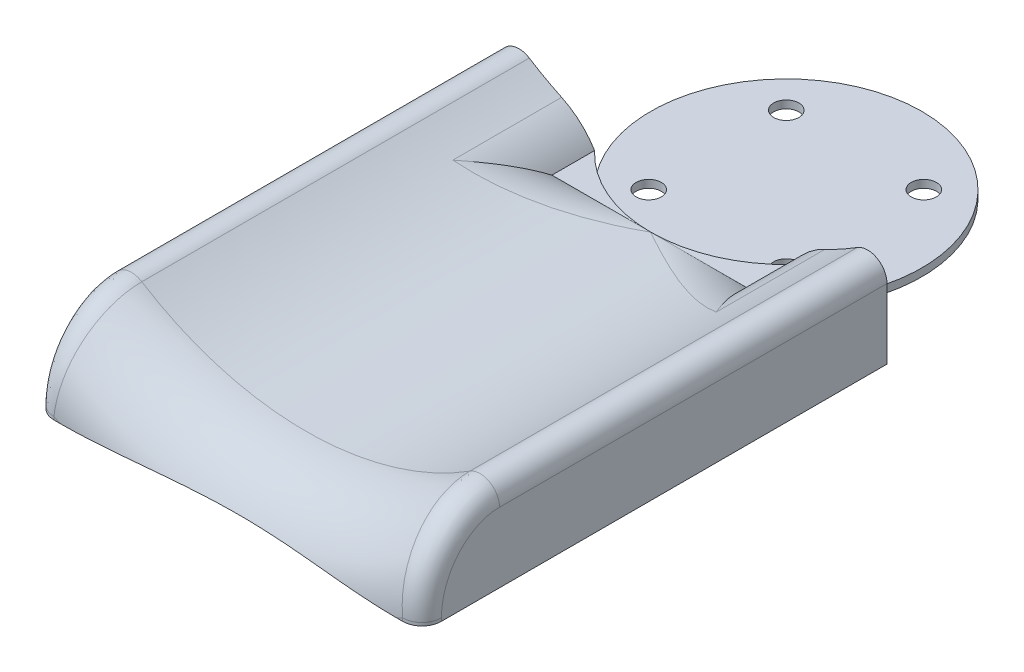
SolidWorks part; units mm, degrees
ref_plane "Front Plane" through (0, 0, 0) normal (0, 0, 1) x (1, 0, 0)
ref_plane "Top Plane" through (0, 0, 0) normal (0, 1, 0) x (1, 0, 0)
ref_plane "Right Plane" through (0, 0, 0) normal (1, 0, 0) x (0, 0, -1)
sketch "Sketch1" plane through (0, 0, 0) normal (0, 1, 0) x (1, 0, 0)
  circle A0 centre (0, 0) radius 35
  dimension "D1" = 70
extrude "Boss-Extrude1" add sketch "Sketch1" along normal blind 2
sketch "Sketch2" plane through (0, 2, 0) normal (0, 1, 0) x (1, 0, 0)
  circle A0 centre (-17.75, 17.75) radius 3.25
  circle A1 centre (17.75, 17.75) radius 3.25
  circle A2 centre (17.75, -17.75) radius 3.25
  circle A3 centre (-17.75, -17.75) radius 3.25
  dimension "D1" = 6.5
  dimension "D2" = 35.5
  dimension "D3" = 17.75
  dimension "D4" = 35.5
  dimension "D5" = 17.75
  dimension "D6" = 35.5
  dimension "D7" = 17.75
  dimension "D8" = 35.5
  dimension "D9" = 17.75
sketch "Sketch4" plane through (0, 2, 0) normal (0, 1, 0) x (1, 0, 0)
  line L0 (-25.4755, -24) -> (25.4755, -24)
  arc A0 (-25.4755, -24) -> (25.4755, -24) centre (0, 0) ccw
  dimension "D1" = 24
extrude "Cut-Extrude3" cut sketch "Sketch4" against normal blind 10
extrude "Cut-Extrude4" cut sketch "Sketch2" against normal through all
sketch "Sketch5" plane through (0, 0, 24) normal (0, 0, 1) x (1, 0, 0)
  line L0 (-50, 0) -> (50, 0)
  line L1 (50, 0) -> (50, 24)
  line L2 (50, 24) -> (-50, 24)
  line L3 (-50, 24) -> (-50, 0)
  dimension "D1" = 24
  dimension "D2" = 100
  dimension "D3" = 50
extrude "Boss-Extrude2" add sketch "Sketch5" along normal blind 120
sketch "Sketch7" plane through (0, 0, 144) normal (0, 0, 1) x (1, 0, 0)
  line L0 (50, 24) -> (-50, 24) construction
  line L1 (-50, 0) -> (50, 0) construction
  arc A0 (-45, 24) -> (45, 24) centre (0, 89.3214) ccw
  point P3 (0, 10)
  dimension "D3" = 10
  dimension "D1" = 90
  dimension "D2" = 45
extrude "Cut-Extrude6" cut sketch "Sketch7" against normal through all and the other way through all
sketch "Sketch9" plane through (0, 24, 0) normal (0, 1, 0) x (1, 0, 0)
  line L0 (-25.4755, -24) -> (25.4755, -24)
  arc A0 (-25.4755, -24) -> (25.4755, -24) centre (0, 0) ccw
extrude "Cut-Extrude7" cut sketch "Sketch9" against normal blind 22
sketch "Sketch11" plane through (0, 24, 0) normal (0, 1, 0) x (1, 0, 0)
  line L0 (0, -35) -> (-25.4755, -35)
  line L2 (-25.4755, -24) -> (-25.4755, -35)
  line L3 (-25.4755, -24) -> (25.4755, -24)
  line L4 (25.4755, -24) -> (25.4755, -35)
  line L6 (25.4755, -35) -> (0, -35)
  arc A0 (-25.4755, -24) -> (25.4755, -24) centre (0, 0) ccw construction
extrude "Cut-Extrude9" cut sketch "Sketch11" against normal blind 14
fillet "Fillet4" radius 20 4 edges at (25.4755, 14.2023, 29.5) (12.9099, 11.0576, 35) (-25.4755, 14.2023, 29.5) (-12.9099, 11.0576, 35)
fillet "Fillet6" radius 20 1 edges at (0, 10, 144)
fillet "Fillet7" radius 5 4 edges at (50, 1.7517, 144) (-50, 1.7517, 144) (50, 18.095, 139.7727) (-50, 13.5033, 142.1035)
ref_plane "Plane1" through (0, 0, 100) normal (0, 0, 1) x (1, 0, 0)
ref_plane "Plane2" through (0, 0, 70) normal (0, 0, 1) x (1, 0, 0)
ref_plane "Plane3" through (0, 0, 24) normal (0, 0, -1) x (-1, 0, 0)
